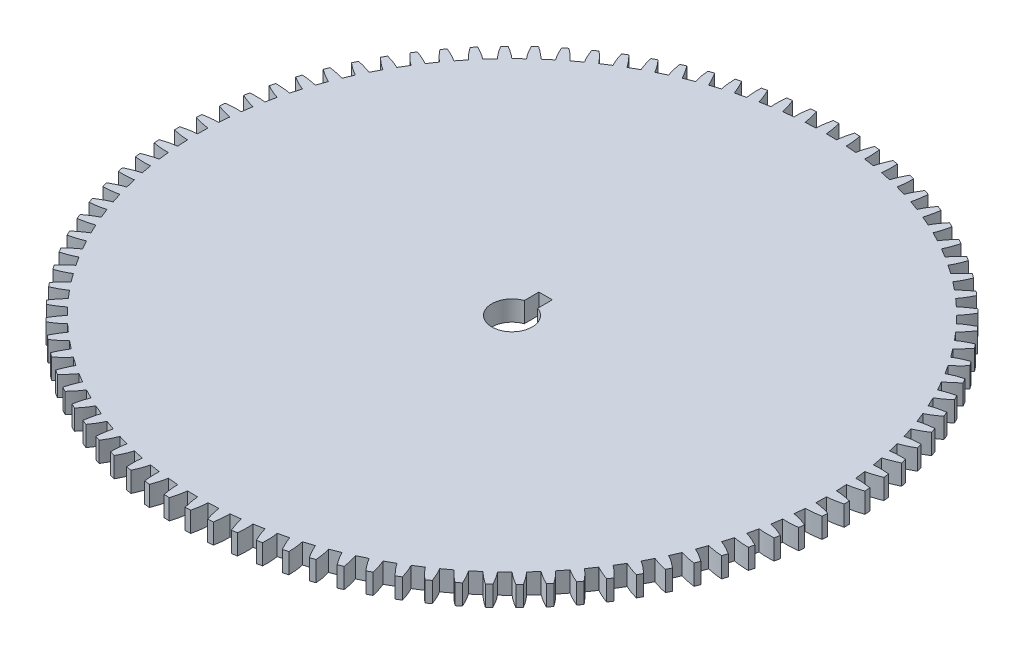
SolidWorks part; units mm, degrees
ref_plane "Front Plane" through (0, 0, 0) normal (0, 0, 1) x (1, 0, 0)
ref_plane "Top Plane" through (0, 0, 0) normal (0, 1, 0) x (1, 0, 0)
ref_plane "Right Plane" through (0, 0, 0) normal (1, 0, 0) x (0, 0, -1)
sketch "Sketch1" plane through (0, 0, 0) normal (0, 1, 0) x (1, 0, 0)
  line L0 (0, 0) -> (0, 23.2355) construction
  line L1 (0, 0) -> (-23.2355, 0) construction
  line L2 (0, 0) -> (-24.4967, -0.4009) construction
  line L3 (0, 0) -> (-23.2231, -0.7602) construction
  line L4 (0, 0) -> (-23.1858, -1.5197) construction
  circle A0 centre (0, 0) radius 24 construction
  circle A1 centre (0, 0) radius 23.2355 construction
  circle A2 centre (0, 0) radius 23.375 construction
  circle A3 centre (0, 0) radius 24.5 construction
  spline S0 degree 4 poles (-23.2355, 0) (-23.2916, 0) (-23.4488, -0.0058) (-23.7449, -0.0394) (-24.2234, -0.1265) (-24.8241, -0.284) (-25.586, -0.5402) (-26.4611, -0.9083) (-27.3945, -1.3807) (-28.3748, -1.965) (-29.3182, -2.6089) (-30.2239, -3.3048) (-31.0922, -4.0466) (-32.1009, -4.9967) (-33.2485, -6.2123) (-34.4919, -7.7248) (-35.7812, -9.5608) (-36.9561, -11.5206) (-37.9959, -13.5551) (-38.7903, -15.3894) (-39.3909, -16.9937) (-39.8389, -18.3486) (-40.1661, -19.4426) (-40.5367, -20.8204) (-40.8568, -22.2122) (-41.1274, -23.6124) (-41.3494, -25.0239) (-41.4982, -26.1527) (-41.6039, -27.1519) (-41.6765, -27.9954) (-41.7263, -28.7234) (-41.7577, -29.2587) (-41.7908, -30.0156) (-41.8049, -30.4909) (-41.8205, -31.2618) (-41.8202, -31.8771) (-41.8173, -32.5385) (-41.8028, -33.0786) (-41.7878, -33.5847) (-41.7778, -33.8082) (-41.7727, -33.9292) knots 0 0 0 0 0 0.005377 0.015084 0.028532 0.04661 0.064855 0.092111 0.119476 0.146842 0.174209 0.201575 0.228941 0.256307 0.307035 0.361767 0.4165 0.471232 0.525964 0.580697 0.608063 0.635429 0.662795 0.690161 0.744894 0.77226 0.799626 0.826992 0.854358 0.868042 0.881725 0.895408 0.909091 0.931818 0.943182 0.954545 0.977273 0.988636 1 1 1 1 1 construction
  spline S1 degree 4 poles (-23.2355, 0) (-23.2916, 0) (-23.4488, -0.0058) (-23.7449, -0.0394) (-24.2234, -0.1265) (-24.8241, -0.284) (-25.586, -0.5402) (-26.4611, -0.9083) (-27.3945, -1.3807) (-28.3748, -1.965) (-29.3182, -2.6089) (-30.2239, -3.3048) (-31.0922, -4.0466) (-32.1009, -4.9967) (-33.2485, -6.2123) (-34.4919, -7.7248) (-35.7812, -9.5608) (-36.9561, -11.5206) (-37.9959, -13.5551) (-38.7903, -15.3894) (-39.3909, -16.9937) (-39.8389, -18.3486) (-40.1661, -19.4426) (-40.5367, -20.8204) (-40.8568, -22.2122) (-41.1274, -23.6124) (-41.3494, -25.0239) (-41.4982, -26.1527) (-41.6039, -27.1519) (-41.6765, -27.9954) (-41.7263, -28.7234) (-41.7577, -29.2587) (-41.779, -29.7458) (-41.7889, -30.0088) (-41.7932, -30.1385) knots 0 0 0 0 0 0.005377 0.015084 0.028532 0.04661 0.064855 0.092111 0.119476 0.146842 0.174209 0.201575 0.228941 0.256307 0.307035 0.361767 0.4165 0.471232 0.525964 0.580697 0.608063 0.635429 0.662795 0.690161 0.744894 0.77226 0.799626 0.826992 0.854358 0.868042 0.881725 0.895408 0.909091 0.909091 0.909091 0.909091 0.909091
  dimension "D1" = 49
  dimension "D2" = 48
  dimension "D3" = 46.4711
  dimension "D4" = 46.75
  dimension "D5" = 23.2355
  dimension "D6" = 0.938
  dimension "D7" = 1.875
  dimension "D8" = 3.75
sketch "Sketch2" plane through (0, 0, 0) normal (0, 1, 0) x (1, 0, 0)
  line L0 (0, 0) -> (-24.4967, -0.4009) construction
  line L1 (0, 0) -> (-24.4967, -0.4009) construction
  line L2 (0, 0) -> (-23.2231, -0.7602) construction
  line L3 (0, 0) -> (-23.2355, 0) construction
  line L4 (0, 0) -> (-23.1858, -1.5197) construction
  line L5 (0, 0) -> (-23.2231, -0.7602) construction
  line L6 (0, 0) -> (-23.2355, 0) construction
  line L7 (0, 0) -> (-23.1858, -1.5197) construction
  line L8 (-23.375, 0) -> (-23.3625, -0.7648) construction
  line L9 (-23.3625, -0.7648) -> (-23.325, -1.5288)
  line L10 (-23.325, -1.5288) -> (-23.1858, -1.5197) construction
  line L11 (-23.325, -1.5288) -> (-1.4968, -0.0981)
  line L12 (-23.2355, 0) -> (-1.5, 0)
  line L13 (-23.2355, 0) -> (-23.375, 0)
  line L14 (-23.375, 0) -> (-23.3749, -0.0043)
  circle A0 centre (0, 0) radius 23.375 construction
  circle A1 centre (0, 0) radius 23.2355 construction
  circle A2 centre (0, 0) radius 24 construction
  circle A3 centre (0, 0) radius 24.5 construction
  circle A4 centre (0, 0) radius 23.375 construction
  circle A5 centre (0, 0) radius 23.2355 construction
  circle A6 centre (0, 0) radius 24 construction
  circle A7 centre (0, 0) radius 24.5 construction
  arc A8 (-24.4927, -0.5986) -> (-24.4992, -0.2031) centre (0, 0) cw
  circle A11 centre (0, 0) radius 1.5 construction
  arc A12 (-1.5, 0) -> (-1.4968, -0.0981) centre (0, 0) ccw
  spline S0 degree 4 poles (-45.7425, -999.7406) (-16.3397, -32.0432) (-18.4257, -0.7547) (-21.364, 0.3936) (-24.2234, -0.1265) (-24.8241, -0.284) (-25.586, -0.5402) (-26.4611, -0.9083) (-27.3945, -1.3807) (-28.3748, -1.965) (-29.3182, -2.6089) (-30.2239, -3.3048) (-31.0922, -4.0466) (-32.1009, -4.9967) (-33.2485, -6.2123) (-34.4919, -7.7248) (-35.7812, -9.5608) (-36.9561, -11.5206) (-37.9959, -13.5551) (-38.7903, -15.3894) (-39.3909, -16.9937) (-39.8389, -18.3486) (-40.1661, -19.4426) (-40.5367, -20.8204) (-40.8568, -22.2122) (-41.1274, -23.6124) (-41.3494, -25.0239) (-41.4982, -26.1527) (-41.6039, -27.1519) (-41.6765, -27.9954) (-41.7263, -28.7234) (-41.8635, -31.0621) (-41.9244, -35.8522) (-40.3894, 3.6572) (-74.4372, -1029.436) knots -0.231928 -0.231928 -0.231928 -0.231928 -0.231928 0.005377 0.015084 0.028532 0.04661 0.064855 0.092111 0.119476 0.146842 0.174209 0.201575 0.228941 0.256307 0.307035 0.361767 0.4165 0.471232 0.525964 0.580697 0.608063 0.635429 0.662795 0.690161 0.744894 0.77226 0.799626 0.826992 0.854358 0.868042 0.881725 0.895408 1.09349 1.09349 1.09349 1.09349 1.09349 only from (-23.2355, 0) to (-41.7932, -30.1385) construction
  spline S1 degree 4 poles (-23.3749, -0.0043) (-23.3961, -0.0055) (-23.5182, -0.0139) (-23.7793, -0.0457) (-24.0606, -0.0969) (-24.3185, -0.1564) (-24.4768, -0.1972) (-24.4992, -0.2031) knots 0.003344 0.003344 0.003344 0.003344 0.003344 0.005377 0.015084 0.028532 0.030752 0.030752 0.030752 0.030752 0.030752
  spline S2 degree 4 poles (-23.3625, -0.7648) (-23.3699, -0.7647) (-23.4535, -0.7633) (-23.6423, -0.7515) (-23.9266, -0.7175) (-24.2007, -0.6663) (-24.3983, -0.6216) (-24.4927, -0.5986) knots 0.004428 0.004428 0.004428 0.004428 0.004428 0.005377 0.015084 0.028532 0.040915 0.040915 0.040915 0.040915 0.040915
  point P18 (-23.3687, -0.3824)
  point P24 (-23.325, -1.5288)
  dimension "D2" = 3
extrude "Boss-Extrude1" add sketch "Sketch2" along normal blind 1.5
pattern_circular "CirPattern1" count 96 over 360 of "Boss-Extrude1"
sketch "Sketch3" plane through (0, 1.5, 0) normal (0, 1, 0) x (1, 0, 0)
  line L1 (0.5, 0.5) -> (-0.5, 0.5)
  line L2 (0.5, 0.5) -> (0.5, 2.5)
  line L3 (0.5, 2.5) -> (-0.5, 2.5)
  line L4 (-0.5, 0.5) -> (-0.5, 2.5)
  line L5 (0.5, 0.5) -> (-0.5, 2.5) construction
  line L6 (0.5, 2.5) -> (-0.5, 0.5) construction
  circle A0 centre (0, 0) radius 1.5 construction
  point P0 (0, 1.5)
  dimension "D1" = 2
  dimension "D2" = 1
extrude "Cut-Extrude1" cut sketch "Sketch3" against normal up to surface (1.5 mm away)
equation "\"Module\"= .5"
equation "\"Number of Teeth\" = 96"
equation "\"Pressure Angle\"= 14.5deg"
equation "\"Pitch Diameter\"= \"Number of Teeth\" * \"Module\""
equation "\"Circular Pitch\"= pi * \"Module\""
equation "\"Addendum\"= \"Module\""
equation "\"Dedendum\"= 1.25 * \"Module\""
equation "\"Base Diameter\"= \"Pitch Diameter\" * cos ( \"Pressure Angle\" )"
equation "\"Base Radius\"= \"Base Diameter\" / 2"
equation "\"Width\"= 1.5mm"
equation "\"Outside Diameter\"= \"Pitch Diameter\" + 2 * \"Addendum\""
equation "\"D1@Sketch1\"=\"Outside Diameter\""
equation "\"D3@Sketch1\"=\"Base Diameter\""
equation "\"Root Diameter\"= \"Pitch Diameter\" - 2 * \"Dedendum\""
equation "\"D4@Sketch1\"=\"Root Diameter\""
equation "\"Tooth Angle\"= 360 / \"Number of Teeth\""
equation "\"D6@Sketch1\"=\"Tooth Angle\"/4"
equation "\"D7@Sketch1\"=\"Tooth Angle\"/2"
equation "\"D8@Sketch1\"=\"Tooth Angle\""
equation "\"D2@Sketch1\" = \"Pitch Diameter\""
equation "\"Shaft Diameter\"= 3mm"
equation "\"D1@CirPattern1\" = \"Number of Teeth\""
equation "\"D2@Sketch2\"  = \"Shaft Diameter\""
equation "\"D1@Boss-Extrude1\" = \"Width\""
